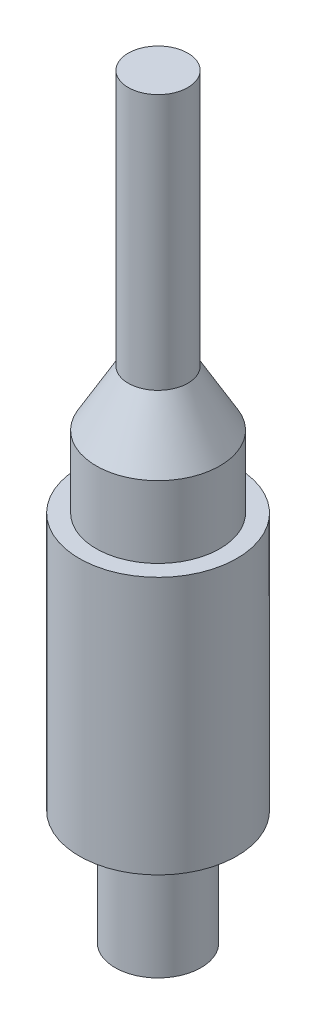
SolidWorks part; units mm, degrees
ref_plane "Front Plane" through (0, 0, 0) normal (0, 0, 1) x (1, 0, 0)
ref_plane "Top Plane" through (0, 0, 0) normal (0, 1, 0) x (1, 0, 0)
ref_plane "Right Plane" through (0, 0, 0) normal (1, 0, 0) x (0, 0, -1)
sketch "Sketch1" plane through (0, 0, 0) normal (0, 0, 1) x (1, 0, 0)
  line L0 (0, -12.9331) -> (0, 38.2393) construction
  line L1 (0, -12.7) -> (4.7625, -12.7)
  line L2 (4.7625, -12.7) -> (4.7625, 0)
  line L3 (4.7625, 0) -> (8.7376, 0)
  line L4 (8.7376, 0) -> (8.7376, 28.575)
  line L5 (8.7376, 28.575) -> (6.858, 28.575)
  line L6 (6.858, 28.575) -> (6.858, 36.5252)
  line L7 (6.858, 36.5252) -> (3.3039, 42.6812)
  line L8 (3.3039, 42.6812) -> (3.3039, 71.0725)
  line L9 (3.3039, 71.0725) -> (0, 71.0725)
  line L10 (0, 71.0725) -> (0, -12.7)
  dimension "D1" = 7.9502
  dimension "D2" = 41.275
  dimension "D3" = 12.7
  dimension "D4" = 9.525
  dimension "D5" = 17.4752
  dimension "D6" = 13.716
  dimension "D7" = 30
revolve "Revolve1" add sketch "Sketch1" angle 360 about L0
